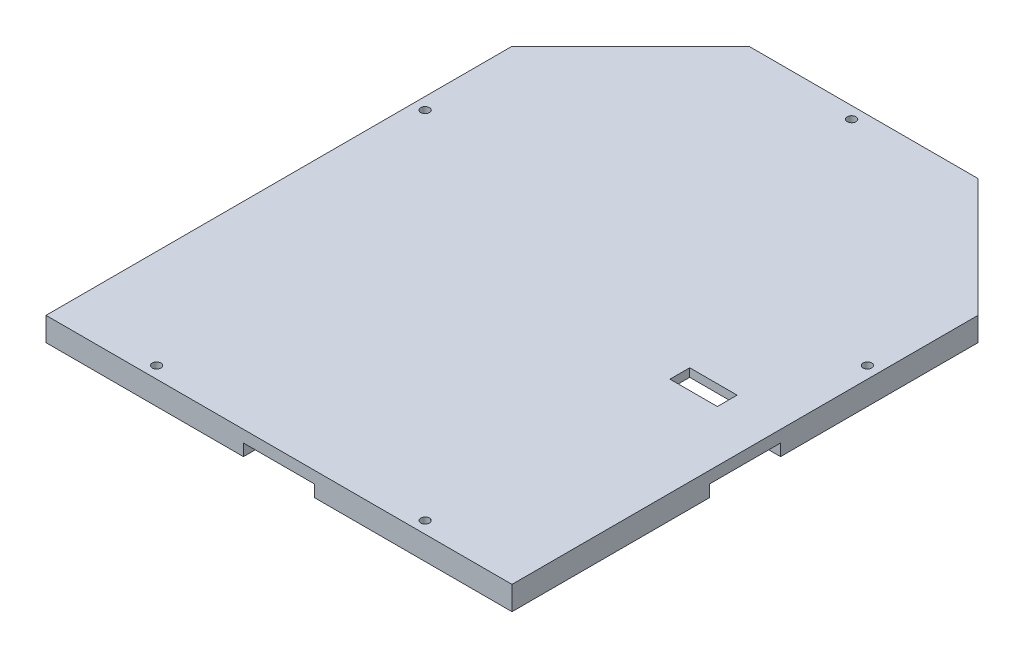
SolidWorks part; units mm, degrees
ref_plane "Plan de face" through (0, 0, 0) normal (0, 0, 1) x (1, 0, 0)
ref_plane "Plan de dessus" through (0, 0, 0) normal (0, 1, 0) x (1, 0, 0)
ref_plane "Plan de droite" through (0, 0, 0) normal (1, 0, 0) x (0, 0, -1)
sketch "Esquisse1" plane through (0, 0, 0) normal (0, 1, 0) x (1, 0, 0)
  line L0 (0, 101.301) -> (0, -77.0945) construction
  line L1 (-59, 59) -> (-29, 89)
  line L2 (-59, 59) -> (-59, -59)
  line L3 (-59, -59) -> (59, -59)
  line L4 (59, 59) -> (59, -59)
  line L5 (-59, 97.3844) -> (-59, -88.3668) construction
  line L6 (-93.3959, 59) -> (76.844, 59) construction
  line L7 (76.844, 0) -> (-81.2306, 0) construction
  line L8 (-53, 56.5147) -> (-53, -53) construction
  line L9 (-81.2306, 34) -> (-54.0627, 34) construction
  line L10 (-56, 41.4687) -> (-56, 21.1567) construction
  line L11 (59, 97.3844) -> (59, -88.3668) construction
  line L12 (-93.3959, -59) -> (76.844, -59) construction
  line L13 (-59, 59) -> (-6.7976, 111.2024) construction
  line L14 (-93.3959, 89) -> (65.2474, 89) construction
  line L15 (59, 59) -> (29, 89)
  line L16 (-29, 89) -> (29, 89)
  line L17 (65.2474, 86) -> (-6.7976, 86) construction
  line L18 (53, -53) -> (-53, -53) construction
  line L19 (26.5147, 83) -> (-26.5147, 83) construction
  line L20 (-53, 56.5147) -> (-26.5147, 83) construction
  line L21 (53, 56.5147) -> (53, -53) construction
  line L22 (53, 56.5147) -> (26.5147, 83) construction
  line L23 (65.2474, 6) -> (31.8673, 6) construction
  line L24 (53, -53) -> (4, -53) construction
  line L25 (53, -53) -> (53, 10) construction
  line L26 (53, 10) -> (4, 10) construction
  line L27 (4, -53) -> (4, 10) construction
  line L28 (65.2474, 11) -> (31.8673, 11) construction
  line L29 (46, -25.5669) -> (46, 15.8511) construction
  line L30 (34, -25.5669) -> (34, 15.8511) construction
  line L32 (34, 6) -> (46, 6)
  line L33 (34, 6) -> (34, 11)
  line L34 (34, 11) -> (46, 11)
  line L35 (46, 6) -> (46, 11)
  circle A1 centre (0, 0) radius 46.5 construction
  circle A5 centre (-56, 34) radius 1.1
  circle A6 centre (34, -56) radius 1.1
  circle A7 centre (56, 34) radius 1.1
  circle A8 centre (-34, -56) radius 1.1
  circle A9 centre (34, 56) radius 1.1
  circle A10 centre (56, -34) radius 1.1
  circle A11 centre (0, 86) radius 1.1
  point P42 (0, 0)
  dimension "D1" = 6
  dimension "D2" = 59
  dimension "D7" = 3
  dimension "D8" = 4
  dimension "D11" = 6
  dimension "D3" = 3
  dimension "D4" = 59
  dimension "D5" = 118
  dimension "D6" = 25
  dimension "D9" = 45
  dimension "D10" = 30
  dimension "D12" = 3
  dimension "D13" = 6
  dimension "D14" = 5
  dimension "D15" = 59
  dimension "D16" = 7
  dimension "D17" = 12
extrude "Boss.-Extru.1" add sketch "Esquisse1" along normal blind 6
sketch "Esquisse2" plane through (0, 0, 0) normal (0, 1, 0) x (1, 0, 0)
  line L0 (77.3131, 0) -> (-9.7402, 0) construction
  line L1 (0, -9.452) -> (0, 33.9732) construction
  line L2 (53, -69.5306) -> (53, 18.5373) construction
  line L3 (77.3131, 9) -> (46.0632, 9) construction
  line L4 (53, 9) -> (73.0805, -11.0805) construction
  line L5 (59, -59) -> (59, 59) construction
  line L6 (53, 6.7373) -> (53, -6.7373)
  line L7 (55.2627, 9) -> (61.024, 9)
  line L8 (55.2627, -9) -> (61.024, -9)
  line L9 (61.024, 9) -> (61.024, -9)
  line L10 (6.7373, -53) -> (-6.7373, -53)
  line L11 (9, -55.2627) -> (9, -61.024)
  line L12 (-9, -55.2627) -> (-9, -61.024)
  line L13 (9, -61.024) -> (-9, -61.024)
  line L14 (-53, -6.7373) -> (-53, 6.7373)
  line L15 (-55.2627, -9) -> (-61.024, -9)
  line L16 (-55.2627, 9) -> (-61.024, 9)
  line L17 (-61.024, -9) -> (-61.024, 9)
  line L22 (-6.7373, 53) -> (6.7373, 53)
  line L23 (-9, 55.2627) -> (-9, 61.024)
  line L24 (9, 55.2627) -> (9, 61.024)
  line L25 (-9, 61.024) -> (9, 61.024)
  arc A0 (55.2627, 9) -> (53, 6.7373) centre (54.1314, 7.8686) ccw
  arc A1 (55.2627, -9) -> (53, -6.7373) centre (54.1314, -7.8686) cw
  arc A2 (9, -55.2627) -> (6.7373, -53) centre (7.8686, -54.1314) ccw
  arc A3 (-9, -55.2627) -> (-6.7373, -53) centre (-7.8686, -54.1314) cw
  arc A4 (-55.2627, -9) -> (-53, -6.7373) centre (-54.1314, -7.8686) ccw
  arc A5 (-55.2627, 9) -> (-53, 6.7373) centre (-54.1314, 7.8686) cw
  arc A8 (-9, 55.2627) -> (-6.7373, 53) centre (-7.8686, 54.1314) ccw
  arc A9 (9, 55.2627) -> (6.7373, 53) centre (7.8686, 54.1314) cw
  point P48 (0, 0)
  dimension "D4" = 4
  dimension "D1" = 9
  dimension "D2" = 45
  dimension "D3" = 6
extrude "Enlèv. mat.-Extru.1" cut sketch "Esquisse2" along normal blind 3
sketch "Esquisse4" plane through (0, 0, 0) normal (0, -1, 0) x (1, 0, 0)
  line L0 (70.7679, -7) -> (31.812, -7) construction
  line L1 (96.2129, 48.7) -> (-24.312, 48.7) construction
  line L2 (-3.8196, -14.8) -> (82.0196, -14.8) construction
  line L3 (96.2129, -24.8) -> (-3.8196, -24.8) construction
  line L4 (53, 66.5797) -> (53, -31.7992) construction
  line L5 (51, 66.5797) -> (51, -31.7992) construction
  line L6 (2, 66.5797) -> (2, -31.7992) construction
  line L7 (26.5, 48.7) -> (26.5, 23.5693) construction
  line L8 (4.9698, 48.7) -> (48.0302, 48.7)
  line L9 (2, 45.7302) -> (2, -24.8)
  line L10 (2, -24.8) -> (51, -24.8)
  line L13 (2, 48.7) -> (19.5417, 31.1583) construction
  line L14 (51, 45.7302) -> (51, -24.8)
  arc A0 (4.9698, 48.7) -> (2, 45.7302) centre (3.4849, 47.2151) ccw
  arc A1 (48.0302, 48.7) -> (51, 45.7302) centre (49.5151, 47.2151) cw
  dimension "D1" = 55.7
  dimension "D2" = 63.5
  dimension "D3" = 73.5
  dimension "D4" = 2
  dimension "D5" = 49
  dimension "D6" = 45
extrude "Enlèv. mat.-Extru.2" cut sketch "Esquisse4" against normal blind 2
sketch "Esquisse5" plane through (0, 0, 0) normal (0, -1, 0) x (1, 0, 0)
  line L0 (74.1223, 48.7) -> (-5.676, 48.7) construction
  line L1 (74.1223, -14.8) -> (-5.676, -14.8) construction
  line L3 (4.9698, -14.8) -> (48.0302, -14.8)
  line L4 (2, -11.8302) -> (2, 45.7302)
  line L5 (4.9698, 48.7) -> (48.0302, 48.7)
  line L6 (51, -11.8302) -> (51, 45.7302)
  line L7 (26.5, 48.7) -> (26.5, 27.764) construction
  line L8 (2, 16.95) -> (23.2509, 16.95) construction
  line L9 (2, -30.8379) -> (2, 63.5485) construction
  line L10 (2, 48.7) -> (22.047, 28.653) construction
  arc A1 (4.9698, 48.7) -> (2, 45.7302) centre (3.4849, 47.2151) ccw
  arc A2 (48.0302, 48.7) -> (51, 45.7302) centre (49.5151, 47.2151) cw
  arc A3 (4.9698, -14.8) -> (2, -11.8302) centre (3.4849, -13.3151) cw
  arc A4 (48.0302, -14.8) -> (51, -11.8302) centre (49.5151, -13.3151) ccw
  dimension "D1" = 63.5
  dimension "D2" = 45
extrude "Enlèv. mat.-Extru.3" cut sketch "Esquisse5" against normal blind 3.9
